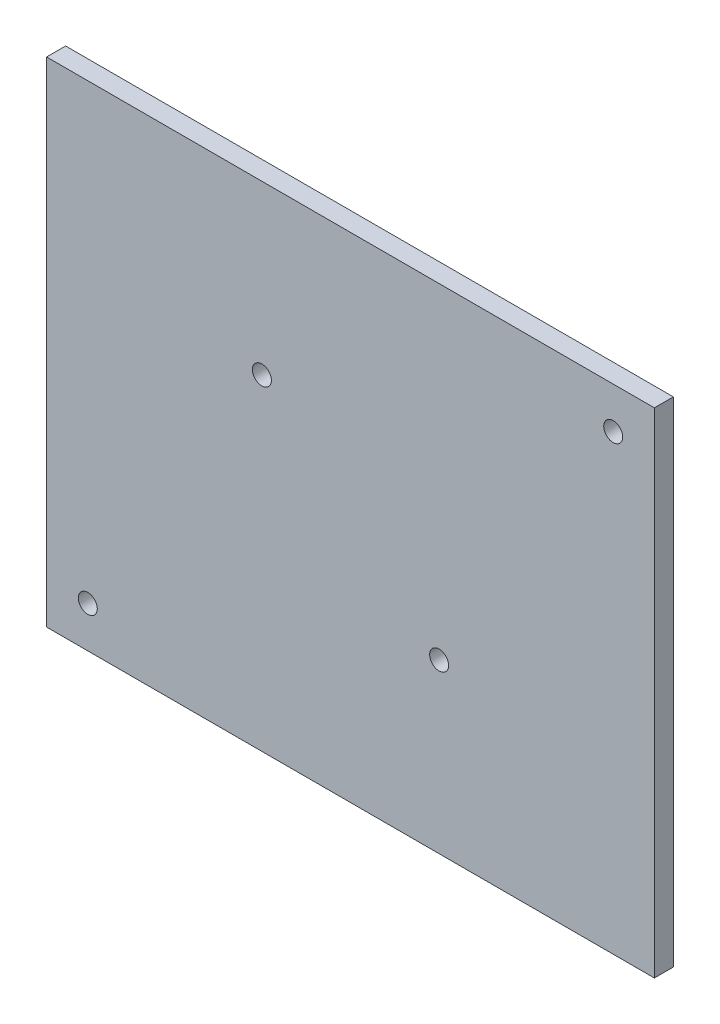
SolidWorks part; units mm, degrees
ref_plane "Alzado" through (0, 0, 0) normal (0, 0, 1) x (1, 0, 0)
ref_plane "Planta" through (0, 0, 0) normal (0, 1, 0) x (1, 0, 0)
ref_plane "Vista lateral" through (0, 0, 0) normal (1, 0, 0) x (0, 0, -1)
sketch "Croquis1" plane through (0, 0, 0) normal (0, 0, 1) x (1, 0, 0)
  line L5 (-48, -39) -> (48, -39)
  line L6 (-48, -39) -> (-48, 39)
  line L19 (-48, 39) -> (48, 39)
  line L24 (48, -39) -> (48, 39)
  line L25 (-48, -39) -> (48, 39) construction
  line L26 (-48, 39) -> (48, -39) construction
  point P0 (0, 0)
  dimension "D1" = 96
  dimension "D2" = 78
extrude "Saliente-Extruir2" add sketch "Croquis1" against normal blind 3
sketch "Croquis2" plane through (0, 0, 0) normal (0, 0, 1) x (1, 0, 0)
  line L0 (0, 39) -> (0, -39) construction
  line L1 (-21.5, 20) -> (21.5, 20) construction
  line L2 (-21.5, 20) -> (-21.5, -20) construction
  line L3 (-21.5, -20) -> (21.5, -20) construction
  line L4 (21.5, 20) -> (21.5, -20) construction
  line L5 (-48, 39) -> (48, 39) construction
  line L6 (0, 20) -> (0, -20) construction
  line L15 (-21.5, 0) -> (21.5, 0) construction
  line L16 (-48, -39) -> (48, -39) construction
  line L17 (-48, 0) -> (48, 0) construction
  line L18 (-48, -39) -> (-48, 39) construction
  line L20 (-48, 39) -> (48, 39)
  line L21 (48, -39) -> (48, 39) construction
  line L22 (-48, 39) -> (-48, -39)
  line L23 (-48, -39) -> (48, -39)
  line L24 (48, 39) -> (48, -39)
  circle A1 centre (-14, 12.5) radius 1.5
  circle A2 centre (14, -12.5) radius 1.5
  circle A3 centre (-41.5, -32.5) radius 1.5 construction
  circle A4 centre (41.5, 32.5) radius 1.5 construction
  circle A5 centre (-41.5, -32.5) radius 1.5
  circle A6 centre (41.5, 32.5) radius 1.5
  point P8 (0, 0)
  dimension "D1" = 7.5
  dimension "D2" = 7.5
  dimension "D3" = 7.5
  dimension "D4" = 3
  dimension "D7" = 3
  dimension "D5" = 43
  dimension "D6" = 40
  dimension "D9" = 7.5
extrude "Cortar-Extruir1" cut sketch "Croquis2" against normal through all flip side to cut
sketch "Sketch6" plane through (0, 0, 0) normal (0, 0, 1) x (1, 0, 0)
  line L0 (1.7275, -9.1526) -> (1.7275, -16.0516)
  line L1 (2.8268, -16.0516) -> (2.8268, -9.1526)
  line L2 (2.2798, -8.9746) -> (2.2801, -8.9746)
  line L3 (-11.373, -9.3975) -> (-11.373, -16.0515)
  line L4 (-10.2742, -16.0515) -> (-10.2742, -12.9911)
  line L5 (-10.2742, -12.9911) -> (-9.54, -12.9911)
  line L6 (-7.8119, -14.3075) -> (-7.0556, -15.9986)
  line L7 (-6.0064, -15.6431) -> (-6.7462, -14.0625)
  line L8 (-9.2084, -9.0081) -> (-10.9645, -9.0083)
  line L9 (-4.2786, -9.3975) -> (-4.2786, -16.0515)
  line L10 (-3.1793, -16.0515) -> (-3.1793, -13.0584)
  line L11 (-3.1793, -13.0584) -> (-0.3195, -13.0584)
  line L12 (-0.3195, -12.2597) -> (-3.1793, -12.2597)
  line L13 (-3.1793, -12.2597) -> (-3.1793, -9.8191)
  line L14 (-3.1793, -9.8191) -> (-0.1539, -9.8191)
  line L15 (-0.1539, -9.0062) -> (-3.8702, -9.0083)
  line L16 (5.024, -9.3975) -> (5.024, -15.8065)
  line L17 (5.4325, -16.1957) -> (7.1771, -16.1957)
  line L18 (7.2987, -9.0086) -> (5.4325, -9.0083)
  line L19 (-10.2744, -9.7961) -> (-9.3524, -9.7961)
  line L20 (-9.2031, -12.2181) -> (-10.2742, -12.2181)
  line L21 (-10.2742, -12.2181) -> (-10.2744, -9.7961)
  line L22 (6.1171, -9.8011) -> (7.2378, -9.8011)
  line L23 (7.2489, -15.3934) -> (6.1171, -15.3934)
  line L24 (6.1171, -15.3934) -> (6.1171, -9.8011)
  line L25 (-11.5, -6.9036) -> (-11.5, 9.9857)
  line L26 (-11.5, 9.9857) -> (-5.3069, 16.2)
  line L27 (-5.3069, 16.2) -> (11.5, 16.2)
  line L28 (11.5, 16.2) -> (11.5, -7.0088)
  line L29 (11.5, -7.0088) -> (10.3931, -8.0105)
  line L30 (10.3931, -8.0105) -> (-10.4983, -8.0105)
  line L31 (-10.4983, -8.0105) -> (-11.5, -6.9036)
  line L32 (10.3297, -3.7737) -> (-8.4737, -3.7737)
  line L33 (-8.4737, -3.7737) -> (-8.4737, 8.8007)
  line L34 (-8.4737, 8.8007) -> (-4.0713, 13.1737)
  line L35 (-4.0713, 13.1737) -> (8.4737, 13.1737)
  line L36 (8.4737, 13.1737) -> (8.4737, -0.7474)
  line L37 (8.4737, -0.7474) -> (-5.4474, -0.7474)
  line L38 (-5.4474, -0.7474) -> (-5.4474, 7.6003)
  line L39 (-2.8521, 10.1474) -> (5.4474, 10.1474)
  line L40 (5.4474, 10.1474) -> (5.4474, 4.0947)
  line L41 (5.4474, 4.0947) -> (2.4211, 4.0947)
  line L42 (2.4211, 4.0947) -> (2.4211, 2.279)
  line L43 (2.4211, 2.279) -> (-2.4211, 2.279)
  line L44 (-2.4211, 2.279) -> (-2.4211, 7.1211)
  line L45 (-2.4211, 7.1211) -> (2.4211, 7.1211)
  line L46 (2.4211, 7.1211) -> (2.4211, 5.3053)
  line L47 (2.4211, 5.3053) -> (4.2369, 5.3053)
  line L48 (4.2369, 5.3053) -> (4.2369, 8.9368)
  line L49 (4.2369, 8.9368) -> (-1.9416, 8.9368)
  line L50 (-4.2368, 6.6956) -> (-4.2368, 0.4632)
  line L51 (-4.2368, 0.4632) -> (7.2632, 0.4632)
  line L52 (7.2632, 0.4632) -> (7.2632, 11.9632)
  line L53 (7.2632, 11.9632) -> (-3.1624, 11.9632)
  line L54 (-7.2631, 7.8939) -> (-7.2631, -2.5632)
  line L55 (-7.2631, -2.5632) -> (10.2895, -2.5632)
  line L56 (10.2895, -2.5632) -> (10.2895, 14.9895)
  line L57 (10.2895, 14.9895) -> (-4.3773, 14.9895)
  line L58 (-10.2895, 9.0995) -> (-10.2895, -5.186)
  line L59 (-10.2895, -5.186) -> (-9.8779, -5.5975)
  line L60 (-9.8779, -5.5975) -> (10.3297, -5.5975)
  line L61 (10.3297, -5.5975) -> (10.3297, -3.7737)
  line L62 (-5.3069, 16.2) -> (-11.5, 9.9857)
  line L63 (-1.9416, 8.9368) -> (-4.2368, 6.6956)
  line L64 (-2.8521, 10.1474) -> (-5.4474, 7.6003)
  line L65 (-3.1624, 11.9632) -> (-7.2631, 7.8939)
  line L66 (-4.3773, 14.9895) -> (-10.2895, 9.0995)
  spline S0 degree 3 poles (2.2801, -8.9746) (2.1823, -8.9746) (2.093, -8.977) (2.0206, -8.9893) knots 0 0 0 0 1 1 1 1
  spline S1 degree 3 poles (2.0206, -8.9893) (1.9525, -8.9967) (1.8962, -9.009) (1.8496, -9.023) knots 0 0 0 0 1 1 1 1
  spline S2 degree 3 poles (1.8496, -9.023) (1.8069, -9.0353) (1.7769, -9.0538) (1.7557, -9.0759) knots 0 0 0 0 1 1 1 1
  spline S3 degree 3 poles (1.7557, -9.0759) (1.7388, -9.098) (1.7275, -9.1231) (1.7275, -9.1526) knots 0 0 0 0 1 1 1 1
  spline S4 degree 3 poles (1.7275, -16.0516) (1.7275, -16.0811) (1.7388, -16.1062) (1.7557, -16.1284) knots 0 0 0 0 1 1 1 1
  spline S5 degree 3 poles (1.7557, -16.1284) (1.7727, -16.1505) (1.8015, -16.1712) (1.8439, -16.1859) knots 0 0 0 0 1 1 1 1
  spline S6 degree 3 poles (1.8439, -16.1859) (1.8863, -16.1982) (1.9429, -16.2031) (2.0149, -16.2105) knots 0 0 0 0 1 1 1 1
  spline S7 degree 3 poles (2.0149, -16.2105) (2.0873, -16.2228) (2.1778, -16.2302) (2.2798, -16.2302) knots 0 0 0 0 1 1 1 1
  spline S8 degree 3 poles (2.2798, -16.2302) (2.3861, -16.2302) (2.4712, -16.2228) (2.5393, -16.2105) knots 0 0 0 0 1 1 1 1
  spline S9 degree 3 poles (2.5393, -16.2105) (2.6117, -16.2031) (2.6679, -16.1982) (2.7103, -16.1859) knots 0 0 0 0 1 1 1 1
  spline S10 degree 3 poles (2.7103, -16.1859) (2.753, -16.1712) (2.7815, -16.1505) (2.7985, -16.1284) knots 0 0 0 0 1 1 1 1
  spline S11 degree 3 poles (2.7985, -16.1284) (2.8155, -16.1062) (2.8268, -16.0811) (2.8268, -16.0516) knots 0 0 0 0 1 1 1 1
  spline S12 degree 3 poles (2.8268, -9.1526) (2.8268, -9.1231) (2.8155, -9.098) (2.7985, -9.0759) knots 0 0 0 0 1 1 1 1
  spline S13 degree 3 poles (2.7985, -9.0759) (2.7815, -9.0538) (2.7527, -9.0341) (2.7103, -9.023) knots 0 0 0 0 1 1 1 1
  spline S14 degree 3 poles (2.7103, -9.023) (2.6676, -9.0083) (2.6114, -8.9967) (2.5393, -8.9893) knots 0 0 0 0 1 1 1 1
  spline S15 degree 3 poles (2.5393, -8.9893) (2.4712, -8.977) (2.3861, -8.9746) (2.2798, -8.9746) knots 0 0 0 0 1 1 1 1
  spline S16 degree 3 poles (-10.9645, -9.0083) (-11.0623, -9.0083) (-11.1567, -9.0356) (-11.2461, -9.0948) knots 0 0 0 0 1 1 1 1
  spline S17 degree 3 poles (-11.2461, -9.0948) (-11.3311, -9.1504) (-11.373, -9.253) (-11.373, -9.3975) knots 0 0 0 0 1 1 1 1
  spline S18 degree 3 poles (-11.373, -16.0515) (-11.373, -16.081) (-11.3673, -16.1061) (-11.3504, -16.1282) knots 0 0 0 0 1 1 1 1
  spline S19 degree 3 poles (-11.3504, -16.1282) (-11.3334, -16.1504) (-11.2992, -16.171) (-11.2565, -16.1858) knots 0 0 0 0 1 1 1 1
  spline S20 degree 3 poles (-11.2565, -16.1858) (-11.2138, -16.1981) (-11.159, -16.203) (-11.0909, -16.2104) knots 0 0 0 0 1 1 1 1
  spline S21 degree 3 poles (-11.0909, -16.2104) (-11.0185, -16.2227) (-10.9323, -16.2301) (-10.826, -16.2301) knots 0 0 0 0 1 1 1 1
  spline S22 degree 3 poles (-10.826, -16.2301) (-10.7197, -16.2301) (-10.629, -16.2227) (-10.5612, -16.2104) knots 0 0 0 0 1 1 1 1
  spline S23 degree 3 poles (-10.5612, -16.2104) (-10.4888, -16.203) (-10.4337, -16.1981) (-10.3955, -16.1858) knots 0 0 0 0 1 1 1 1
  spline S24 degree 3 poles (-10.3955, -16.1858) (-10.3528, -16.171) (-10.3243, -16.1504) (-10.3073, -16.1282) knots 0 0 0 0 1 1 1 1
  spline S25 degree 3 poles (-10.3073, -16.1282) (-10.2847, -16.1061) (-10.2742, -16.081) (-10.2742, -16.0515) knots 0 0 0 0 1 1 1 1
  spline S26 degree 3 poles (-9.54, -12.9911) (-9.2889, -12.9911) (-9.0782, -13.0253) (-8.8995, -13.092) knots 0 0 0 0 1 1 1 1
  spline S27 degree 3 poles (-8.8995, -13.092) (-8.7209, -13.155) (-8.5622, -13.2425) (-8.4303, -13.361) knots 0 0 0 0 1 1 1 1
  spline S28 degree 3 poles (-8.4303, -13.361) (-8.2982, -13.4759) (-8.1872, -13.6161) (-8.0935, -13.779) knots 0 0 0 0 1 1 1 1
  spline S29 degree 3 poles (-8.0935, -13.779) (-7.9957, -13.9382) (-7.9013, -14.1149) (-7.8119, -14.3075) knots 0 0 0 0 1 1 1 1
  spline S30 degree 3 poles (-7.0556, -15.9986) (-7.0386, -16.0431) (-7.016, -16.0795) (-6.9948, -16.1091) knots 0 0 0 0 1 1 1 1
  spline S31 degree 3 poles (-6.9948, -16.1091) (-6.9694, -16.1386) (-6.938, -16.1674) (-6.8953, -16.1858) knots 0 0 0 0 1 1 1 1
  spline S32 degree 3 poles (-6.8953, -16.1858) (-6.8529, -16.2006) (-6.7978, -16.2079) (-6.7297, -16.2146) knots 0 0 0 0 1 1 1 1
  spline S33 degree 3 poles (-6.7297, -16.2146) (-6.6573, -16.222) (-6.5643, -16.2293) (-6.4535, -16.2293) knots 0 0 0 0 1 1 1 1
  spline S34 degree 3 poles (-6.4535, -16.2293) (-6.326, -16.2293) (-6.2209, -16.222) (-6.1444, -16.2146) knots 0 0 0 0 1 1 1 1
  spline S35 degree 3 poles (-6.1444, -16.2146) (-6.0678, -16.2072) (-6.0104, -16.1998) (-5.9677, -16.1858) knots 0 0 0 0 1 1 1 1
  spline S36 degree 3 poles (-5.9677, -16.1858) (-5.9253, -16.171) (-5.8976, -16.1504) (-5.8849, -16.1282) knots 0 0 0 0 1 1 1 1
  spline S37 degree 3 poles (-5.8849, -16.1282) (-5.8707, -16.1061) (-5.8679, -16.081) (-5.8679, -16.0515) knots 0 0 0 0 1 1 1 1
  spline S38 degree 3 poles (-5.8679, -16.0515) (-5.8679, -16.022) (-5.8736, -15.9784) (-5.8905, -15.9265) knots 0 0 0 0 1 1 1 1
  spline S39 degree 3 poles (-5.8905, -15.9265) (-5.9075, -15.8709) (-5.9468, -15.7765) (-6.0064, -15.6431) knots 0 0 0 0 1 1 1 1
  spline S40 degree 3 poles (-6.7462, -14.0625) (-6.8313, -13.8809) (-6.915, -13.7168) (-7.0001, -13.5724) knots 0 0 0 0 1 1 1 1
  spline S41 degree 3 poles (-7.0001, -13.5724) (-7.0851, -13.428) (-7.1781, -13.2992) (-7.2762, -13.1881) knots 0 0 0 0 1 1 1 1
  spline S42 degree 3 poles (-7.2762, -13.1881) (-7.3698, -13.0769) (-7.4693, -12.9825) (-7.5799, -12.9046) knots 0 0 0 0 1 1 1 1
  spline S43 degree 3 poles (-7.5799, -12.9046) (-7.6904, -12.8232) (-7.8193, -12.7595) (-7.9553, -12.7076) knots 0 0 0 0 1 1 1 1
  spline S44 degree 3 poles (-7.9553, -12.7076) (-7.7128, -12.6336) (-7.4885, -12.5411) (-7.2928, -12.4337) knots 0 0 0 0 1 1 1 1
  spline S45 degree 3 poles (-7.2928, -12.4337) (-7.0972, -12.3263) (-6.9308, -12.2035) (-6.7904, -12.059) knots 0 0 0 0 1 1 1 1
  spline S46 degree 3 poles (-6.7904, -12.059) (-6.6499, -11.9109) (-6.5425, -11.7386) (-6.4702, -11.5497) knots 0 0 0 0 1 1 1 1
  spline S47 degree 3 poles (-6.4702, -11.5497) (-6.3936, -11.3571) (-6.3596, -11.1418) (-6.3596, -10.9012) knots 0 0 0 0 1 1 1 1
  spline S48 degree 3 poles (-6.3596, -10.9012) (-6.3596, -10.6531) (-6.4015, -10.4274) (-6.4866, -10.2238) knots 0 0 0 0 1 1 1 1
  spline S49 degree 3 poles (-6.4866, -10.2238) (-6.5674, -10.0164) (-6.6907, -9.8353) (-6.8565, -9.6761) knots 0 0 0 0 1 1 1 1
  spline S50 degree 3 poles (-6.8565, -9.6761) (-7.0224, -9.5169) (-7.228, -9.3858) (-7.4748, -9.2821) knots 0 0 0 0 1 1 1 1
  spline S51 degree 3 poles (-7.4748, -9.2821) (-7.7173, -9.1786) (-7.9949, -9.0996) (-8.314, -9.0516) knots 0 0 0 0 1 1 1 1
  spline S52 degree 3 poles (-8.314, -9.0516) (-8.4245, -9.0393) (-8.5545, -9.0295) (-8.6949, -9.0229) knots 0 0 0 0 1 1 1 1
  spline S53 degree 3 poles (-8.6949, -9.0229) (-8.8312, -9.0106) (-8.9999, -9.0081) (-9.2084, -9.0081) knots 0 0 0 0 1 1 1 1
  spline S54 degree 3 poles (-3.8702, -9.0083) (-3.968, -9.0083) (-4.0624, -9.0356) (-4.1517, -9.0948) knots 0 0 0 0 1 1 1 1
  spline S55 degree 3 poles (-4.1517, -9.0948) (-4.2368, -9.1504) (-4.2786, -9.253) (-4.2786, -9.3975) knots 0 0 0 0 1 1 1 1
  spline S56 degree 3 poles (-4.2786, -16.0515) (-4.2786, -16.0773) (-4.2673, -16.1024) (-4.2504, -16.1282) knots 0 0 0 0 1 1 1 1
  spline S57 degree 3 poles (-4.2504, -16.1282) (-4.2334, -16.1504) (-4.2046, -16.171) (-4.1622, -16.1858) knots 0 0 0 0 1 1 1 1
  spline S58 degree 3 poles (-4.1622, -16.1858) (-4.1198, -16.1981) (-4.0632, -16.203) (-3.9912, -16.2104) knots 0 0 0 0 1 1 1 1
  spline S59 degree 3 poles (-3.9912, -16.2104) (-3.9188, -16.2227) (-3.8283, -16.2301) (-3.7263, -16.2301) knots 0 0 0 0 1 1 1 1
  spline S60 degree 3 poles (-3.7263, -16.2301) (-3.6158, -16.2301) (-3.5293, -16.2227) (-3.4614, -16.2104) knots 0 0 0 0 1 1 1 1
  spline S61 degree 3 poles (-3.4614, -16.2104) (-3.3933, -16.203) (-3.3385, -16.1981) (-3.2958, -16.1858) knots 0 0 0 0 1 1 1 1
  spline S62 degree 3 poles (-3.2958, -16.1858) (-3.2531, -16.171) (-3.2189, -16.1504) (-3.2019, -16.1282) knots 0 0 0 0 1 1 1 1
  spline S63 degree 3 poles (-3.2019, -16.1282) (-3.185, -16.1024) (-3.1793, -16.0773) (-3.1793, -16.0515) knots 0 0 0 0 1 1 1 1
  spline S64 degree 3 poles (-0.3195, -13.0584) (-0.2898, -13.0584) (-0.2621, -13.0485) (-0.2367, -13.0338) knots 0 0 0 0 1 1 1 1
  spline S65 degree 3 poles (-0.2367, -13.0338) (-0.207, -13.0141) (-0.1807, -12.9912) (-0.1592, -12.9617) knots 0 0 0 0 1 1 1 1
  spline S66 degree 3 poles (-0.1592, -12.9617) (-0.1366, -12.9285) (-0.1236, -12.8896) (-0.1151, -12.8417) knots 0 0 0 0 1 1 1 1
  spline S67 degree 3 poles (-0.1151, -12.8417) (-0.1067, -12.7898) (-0.1038, -12.7246) (-0.1038, -12.6542) knots 0 0 0 0 1 1 1 1
  spline S68 degree 3 poles (-0.1038, -12.6542) (-0.1038, -12.5765) (-0.1064, -12.515) (-0.1151, -12.4668) knots 0 0 0 0 1 1 1 1
  spline S69 degree 3 poles (-0.1151, -12.4668) (-0.1236, -12.4149) (-0.1378, -12.3763) (-0.1592, -12.3468) knots 0 0 0 0 1 1 1 1
  spline S70 degree 3 poles (-0.1592, -12.3468) (-0.1819, -12.3172) (-0.2067, -12.2954) (-0.2367, -12.2843) knots 0 0 0 0 1 1 1 1
  spline S71 degree 3 poles (-0.2367, -12.2843) (-0.2621, -12.2695) (-0.2898, -12.2597) (-0.3195, -12.2597) knots 0 0 0 0 1 1 1 1
  spline S72 degree 3 poles (-0.1539, -9.8191) (-0.1242, -9.8191) (-0.0965, -9.8093) (-0.0711, -9.7945) knots 0 0 0 0 1 1 1 1
  spline S73 degree 3 poles (-0.0711, -9.7945) (-0.0414, -9.7798) (-0.0151, -9.7569) (0.0061, -9.7274) knots 0 0 0 0 1 1 1 1
  spline S74 degree 3 poles (0.0061, -9.7274) (0.0287, -9.6942) (0.0417, -9.6543) (0.0502, -9.6024) knots 0 0 0 0 1 1 1 1
  spline S75 degree 3 poles (0.0502, -9.6024) (0.0587, -9.5505) (0.0615, -9.4853) (0.0615, -9.415) knots 0 0 0 0 1 1 1 1
  spline S76 degree 3 poles (0.0615, -9.415) (0.0615, -9.3446) (0.059, -9.2844) (0.0502, -9.2325) knots 0 0 0 0 1 1 1 1
  spline S77 degree 3 poles (0.0502, -9.2325) (0.0417, -9.1769) (0.0276, -9.136) (0.0061, -9.1028) knots 0 0 0 0 1 1 1 1
  spline S78 degree 3 poles (0.0061, -9.1028) (-0.0165, -9.0694) (-0.0414, -9.0455) (-0.0711, -9.0308) knots 0 0 0 0 1 1 1 1
  spline S79 degree 3 poles (-0.0711, -9.0308) (-0.0965, -9.016) (-0.1242, -9.0062) (-0.1539, -9.0062) knots 0 0 0 0 1 1 1 1
  spline S80 degree 3 poles (5.4325, -9.0083) (5.3347, -9.0083) (5.2403, -9.0356) (5.151, -9.0948) knots 0 0 0 0 1 1 1 1
  spline S81 degree 3 poles (5.151, -9.0948) (5.0659, -9.1504) (5.024, -9.253) (5.024, -9.3975) knots 0 0 0 0 1 1 1 1
  spline S82 degree 3 poles (5.024, -15.8065) (5.024, -15.9508) (5.0659, -16.05) (5.151, -16.1091) knots 0 0 0 0 1 1 1 1
  spline S83 degree 3 poles (5.151, -16.1091) (5.2403, -16.1647) (5.3347, -16.1957) (5.4325, -16.1957) knots 0 0 0 0 1 1 1 1
  spline S84 degree 3 poles (7.1771, -16.1957) (7.8834, -16.1957) (8.4939, -16.117) (9.0045, -15.9652) knots 0 0 0 0 1 1 1 1
  spline S85 degree 3 poles (9.0045, -15.9652) (9.5151, -15.8135) (9.9475, -15.5866) (10.2964, -15.283) knots 0 0 0 0 1 1 1 1
  spline S86 degree 3 poles (10.2964, -15.283) (10.6495, -14.9757) (10.914, -14.5928) (11.0969, -14.13) knots 0 0 0 0 1 1 1 1
  spline S87 degree 3 poles (11.0969, -14.13) (11.2798, -13.6635) (11.3731, -13.1186) (11.3731, -12.4965) knots 0 0 0 0 1 1 1 1
  spline S88 degree 3 poles (11.3731, -12.4965) (11.3731, -11.956) (11.288, -11.4703) (11.1136, -11.0408) knots 0 0 0 0 1 1 1 1
  spline S89 degree 3 poles (11.1136, -11.0408) (10.9434, -10.6113) (10.6878, -10.2454) (10.3517, -9.9455) knots 0 0 0 0 1 1 1 1
  spline S90 degree 3 poles (10.3517, -9.9455) (10.0198, -9.6418) (9.6086, -9.4128) (9.1151, -9.2536) knots 0 0 0 0 1 1 1 1
  spline S91 degree 3 poles (9.1151, -9.2536) (8.6215, -9.0908) (8.0135, -9.0086) (7.2987, -9.0086) knots 0 0 0 0 1 1 1 1
  spline S92 degree 3 poles (-9.3524, -9.7961) (-9.1353, -9.7961) (-8.9598, -9.8035) (-8.8279, -9.8158) knots 0 0 0 0 1 1 1 1
  spline S93 degree 3 poles (-8.8279, -9.8158) (-8.6917, -9.8281) (-8.5699, -9.8426) (-8.4636, -9.8687) knots 0 0 0 0 1 1 1 1
  spline S94 degree 3 poles (-8.4636, -9.8687) (-8.1232, -9.9538) (-7.8795, -10.0953) (-7.7348, -10.2915) knots 0 0 0 0 1 1 1 1
  spline S95 degree 3 poles (-7.7348, -10.2915) (-7.5901, -10.4841) (-7.5194, -10.7211) (-7.5194, -11.0025) knots 0 0 0 0 1 1 1 1
  spline S96 degree 3 poles (-7.5194, -11.0025) (-7.5194, -11.1764) (-7.5508, -11.3396) (-7.6186, -11.4878) knots 0 0 0 0 1 1 1 1
  spline S97 degree 3 poles (-7.6186, -11.4878) (-7.6825, -11.6358) (-7.7874, -11.761) (-7.9278, -11.8721) knots 0 0 0 0 1 1 1 1
  spline S98 degree 3 poles (-7.9278, -11.8721) (-8.0683, -11.9793) (-8.2451, -12.0686) (-8.4578, -12.1315) knots 0 0 0 0 1 1 1 1
  spline S99 degree 3 poles (-8.4578, -12.1315) (-8.6664, -12.1908) (-8.9138, -12.2181) (-9.2031, -12.2181) knots 0 0 0 0 1 1 1 1
  spline S100 degree 3 poles (7.2378, -9.8011) (7.808, -9.8011) (8.273, -9.8707) (8.6346, -10.0077) knots 0 0 0 0 1 1 1 1
  spline S101 degree 3 poles (8.6346, -10.0077) (8.9963, -10.1447) (9.295, -10.335) (9.529, -10.5794) knots 0 0 0 0 1 1 1 1
  spline S102 degree 3 poles (9.529, -10.5794) (9.7673, -10.8239) (9.9428, -11.1168) (10.0535, -11.4538) knots 0 0 0 0 1 1 1 1
  spline S103 degree 3 poles (10.0535, -11.4538) (10.164, -11.787) (10.2191, -12.146) (10.2191, -12.5347) knots 0 0 0 0 1 1 1 1
  spline S104 degree 3 poles (10.2191, -12.5347) (10.2191, -13.0235) (10.1547, -13.4487) (10.0314, -13.8079) knots 0 0 0 0 1 1 1 1
  spline S105 degree 3 poles (10.0314, -13.8079) (9.9124, -14.1633) (9.7329, -14.4597) (9.4904, -14.6967) knots 0 0 0 0 1 1 1 1
  spline S106 degree 3 poles (9.4904, -14.6967) (9.2478, -14.9336) (8.9466, -15.1104) (8.585, -15.2252) knots 0 0 0 0 1 1 1 1
  spline S107 degree 3 poles (8.585, -15.2252) (8.2233, -15.34) (7.7765, -15.3934) (7.2489, -15.3934) knots 0 0 0 0 1 1 1 1
  spline S108 degree 3 poles (-5.4474, 7.6003) (-4.5823, 8.4493) (-3.7172, 9.2983) (-2.8521, 10.1474) knots 0 0 0 0 1 1 1 1
  spline S109 degree 3 poles (-1.9416, 8.9368) (-2.7067, 8.1898) (-3.4717, 7.4427) (-4.2368, 6.6956) knots 0 0 0 0 1 1 1 1
  spline S110 degree 3 poles (-3.1624, 11.9632) (-4.5293, 10.6067) (-5.8962, 9.2503) (-7.2631, 7.8939) knots 0 0 0 0 1 1 1 1
  spline S111 degree 2 poles (-4.3773, 14.9895) (-8.3188, 11.0628) (-10.2895, 9.0995) knots 0 0 0 1 1 1
